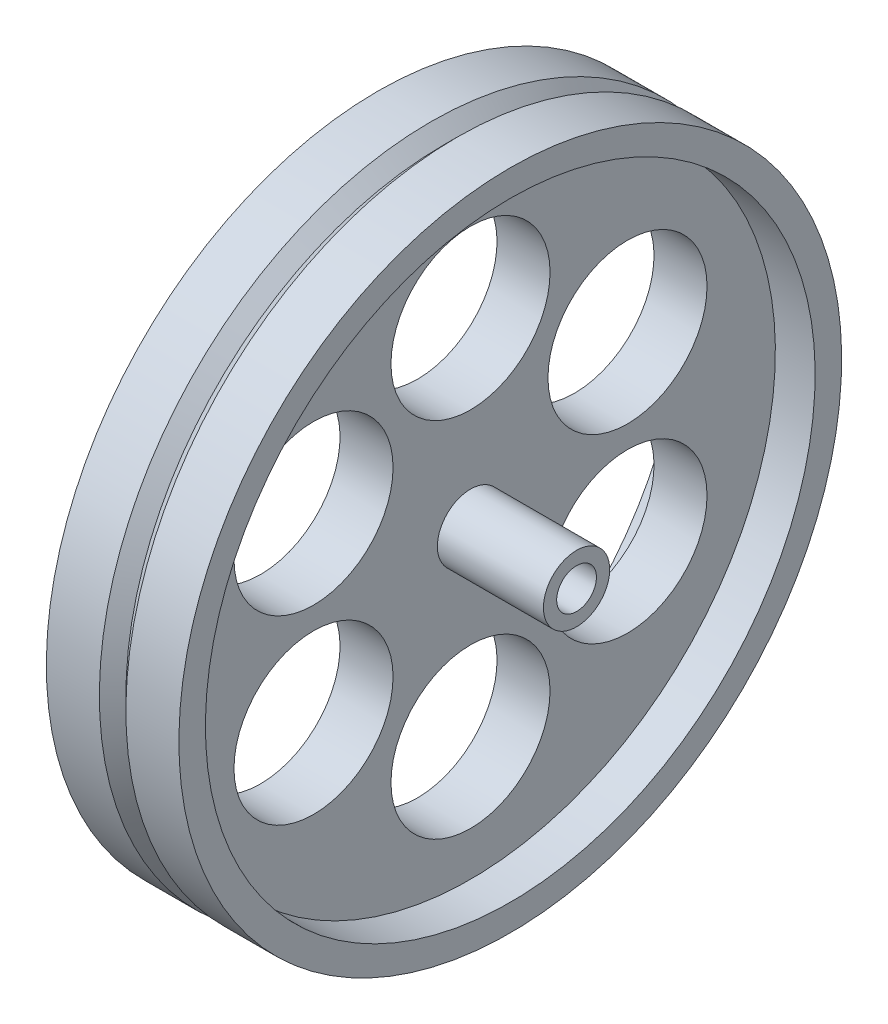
SolidWorks part; units mm, degrees
ref_plane "Front Plane" through (0, 0, 0) normal (0, 0, 1) x (1, 0, 0)
ref_plane "Top Plane" through (0, 0, 0) normal (0, 1, 0) x (1, 0, 0)
ref_plane "Right Plane" through (0, 0, 0) normal (1, 0, 0) x (0, 0, -1)
sketch "Sketch2" plane through (0, 0, 0) normal (0, 0, 1) x (1, 0, 0)
  line L0 (0, 0) -> (0, 2)
  line L5 (0, 47) -> (8, 47)
  line L6 (20, 47) -> (20, 43)
  line L9 (20, 2) -> (30, 2)
  line L10 (30, 2) -> (30, 0)
  line L11 (30, 0) -> (0, 0)
  line L12 (30, -3) -> (-23.6075, -3) construction
  line L19 (12, 47) -> (20, 47)
  line L20 (0, 47) -> (0, 43)
  line L21 (0, 43) -> (6, 43)
  line L22 (6, 43) -> (6, 2)
  line L23 (6, 2) -> (0, 2)
  line L24 (10, 0) -> (10, -1.3827) construction
  line L25 (14, 2) -> (20, 2)
  line L26 (20, 43) -> (14, 43)
  line L27 (14, 43) -> (14, 2)
  line L28 (8, 47) -> (10, 45)
  line L29 (10, 45) -> (12, 47)
  point P15 (10, 47)
  dimension "D1" = 20
  dimension "D2" = 3
  dimension "D3" = 50
  dimension "D4" = 30
  dimension "D5" = 4
  dimension "D6" = 5
  dimension "D9" = 6
  dimension "D10" = 16
  dimension "D11" = 6
revolve "Revolve1" add sketch "Sketch2" angle 360 about L12
sketch "Sketch3" plane through (0, 0, 0) normal (-1, 0, 0) x (0, 0, 1)
  circle A0 centre (23.6873, 10.6759) radius 12
  circle A1 centre (0, 24.3517) radius 12
  circle A2 centre (23.6873, -16.6759) radius 12
  circle A3 centre (0, -30.3517) radius 12
  circle A4 centre (-23.6873, -16.6759) radius 12
  circle A5 centre (-23.6873, 10.6759) radius 12
  point P15 (0, -3)
  dimension "D2" = 24
  dimension "D1" = 6
extrude "Cut-Extrude1" cut sketch "Sketch3" against normal up to surface (20 mm away)
